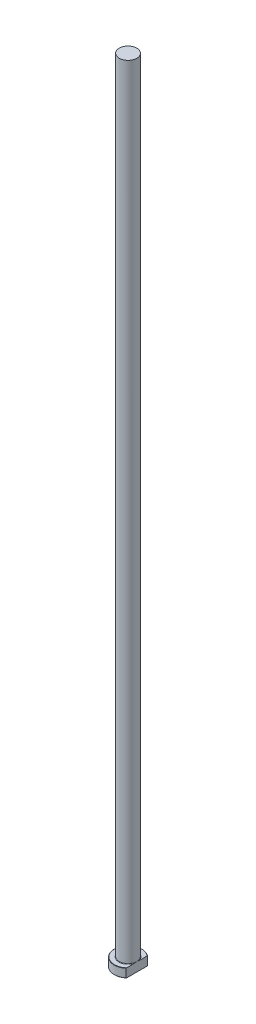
SolidWorks part; units mm, degrees
ref_plane "Front Plane" through (0, 0, 0) normal (0, 0, 1) x (1, 0, 0)
ref_plane "Top Plane" through (0, 0, 0) normal (0, 1, 0) x (1, 0, 0)
ref_plane "Right Plane" through (0, 0, 0) normal (1, 0, 0) x (0, 0, -1)
sketch "Sketch1" plane through (0, 0, 0) normal (0, 0, 1) x (1, 0, 0)
  line L0 (0, 259.9588) -> (0, -15.1925) construction
  line L1 (0, 0) -> (-11, 0)
  line L2 (-11, 0) -> (-11, 7)
  line L3 (-11, 7) -> (-7, 7)
  line L4 (-7, 7) -> (-7, 630)
  line L5 (-7, 630) -> (0, 630)
  line L6 (0, 630) -> (0, 0)
  dimension "L" = 630
  dimension "H" = 22
  dimension "T" = 7
  dimension "D" = 14
revolve "Revolve1" add sketch "Sketch1" angle 360 about L0
chamfer "Chamfer1" distance 0.2 angle 45 2 edges at (0, 7, 11) (0, 0, 11)
fillet "Fillet1" radius 0.3 1 edges at (0, 7, 7)
sketch "Sketch2" plane through (0, 0, 0) normal (0, 1, 0) x (1, 0, 0)
  line L0 (7, 8.4853) -> (7, -8.4853)
  circle A0 centre (0, 0) radius 11 construction
  arc A1 (7, -8.4853) -> (7, 8.4853) centre (0, 0) ccw
  circle A2 centre (0, 0) radius 7 construction
extrude "KEY" cut sketch "Sketch2" along normal through all
